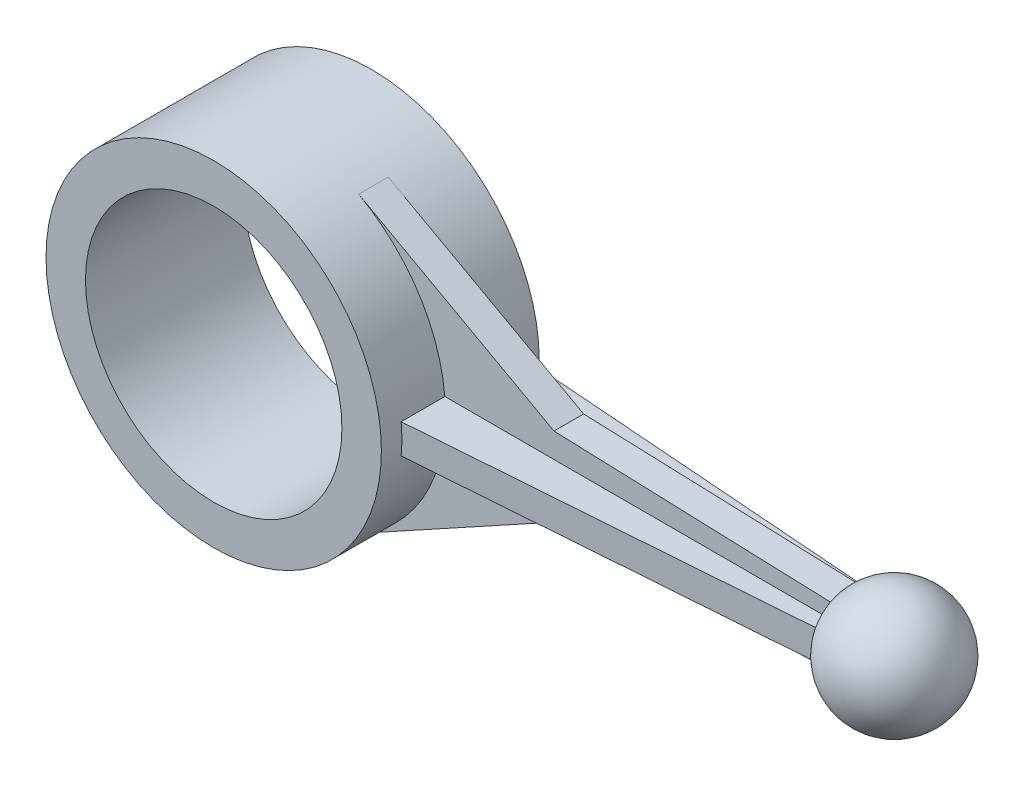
SolidWorks part; units mm, degrees
ref_plane "Plan1" through (0, 0, 0) normal (0, 0, 1) x (1, 0, 0)
ref_plane "Plan2" through (0, 0, 0) normal (0, 1, 0) x (1, 0, 0)
ref_plane "Plan3" through (0, 0, 0) normal (1, 0, 0) x (0, 0, -1)
sketch "Esquisse2" plane through (0, 0, 0) normal (0, 0, 1) x (1, 0, 0)
  circle A0 centre (0, 0) radius 8.5
  circle A1 centre (0, 0) radius 6.5
  dimension "D1" = 17
  dimension "D2" = 13
extrude "Base-Extrusion" add sketch "Esquisse2" along normal mid plane 8
sketch "Esquisse3" plane through (0, 0, 0) normal (0, 0, 1) x (1, 0, 0)
  line L0 (8.5, 0) -> (28, 0)
  line L1 (28, 0) -> (28, 1.5)
  line L2 (28, 1.5) -> (14, 2)
  line L3 (14, 2) -> (4.0968, 7.4476)
  arc A0 (8.5, 0) -> (4.0968, 7.4476) centre (0, 0) ccw
  dimension "D1" = 17
  dimension "D2" = 19.5
  dimension "D3" = 1.5
  dimension "D4" = 14
  dimension "D5" = 0.5
  dimension "D6" = 9.9032
extrude "Boss.-Extru.1" add sketch "Esquisse3" along normal mid plane 1.5
sketch "Esquisse5" plane through (0, 0, 0) normal (0, -1, 0) x (1, 0, 0)
  line L0 (28, 0) -> (28, -1.5)
  line L1 (28, 0.75) -> (28, -0.75) construction
  line L2 (28, -1.5) -> (8, -3)
  line L3 (8, -3) -> (8, 0)
  line L4 (8, 0) -> (28, 0)
  dimension "D1" = 1.5
  dimension "D2" = 20
  dimension "D3" = 3
extrude "Boss.-Extru.2" add sketch "Esquisse5" along normal mid plane 1.5
pattern_circular "Répétition circulaire4" count 2 every 180
sketch "Esquisse6" plane through (0, 0, 0) normal (0, 1, 0) x (1, 0, 0)
  line L0 (28, 0) -> (28, -1.5)
  line L1 (28, -0.75) -> (28, 0.75) construction
  line L2 (28, -1.5) -> (8, -3)
  line L3 (8, -3) -> (8, 0)
  line L4 (8, 0) -> (28, 0)
  dimension "D1" = 1.5
  dimension "D2" = 20
  dimension "D3" = 3
extrude "Boss.-Extru.3" add sketch "Esquisse6" along normal mid plane 1.5
sketch "Esquisse7" plane through (0, 0, 0) normal (0, 1, 0) x (1, 0, 0)
  line L3 (27.5, 0) -> (33.5, 0)
  line L4 (33.5, 0) -> (21, 0) construction
  arc A0 (33.5, 0) -> (27.5, 0) centre (30.5, 0) ccw
  dimension "D1" = 6
  dimension "D2" = 2.5
revolve "Boss.-Révol.1" add sketch "Esquisse7" angle 360 about L4
